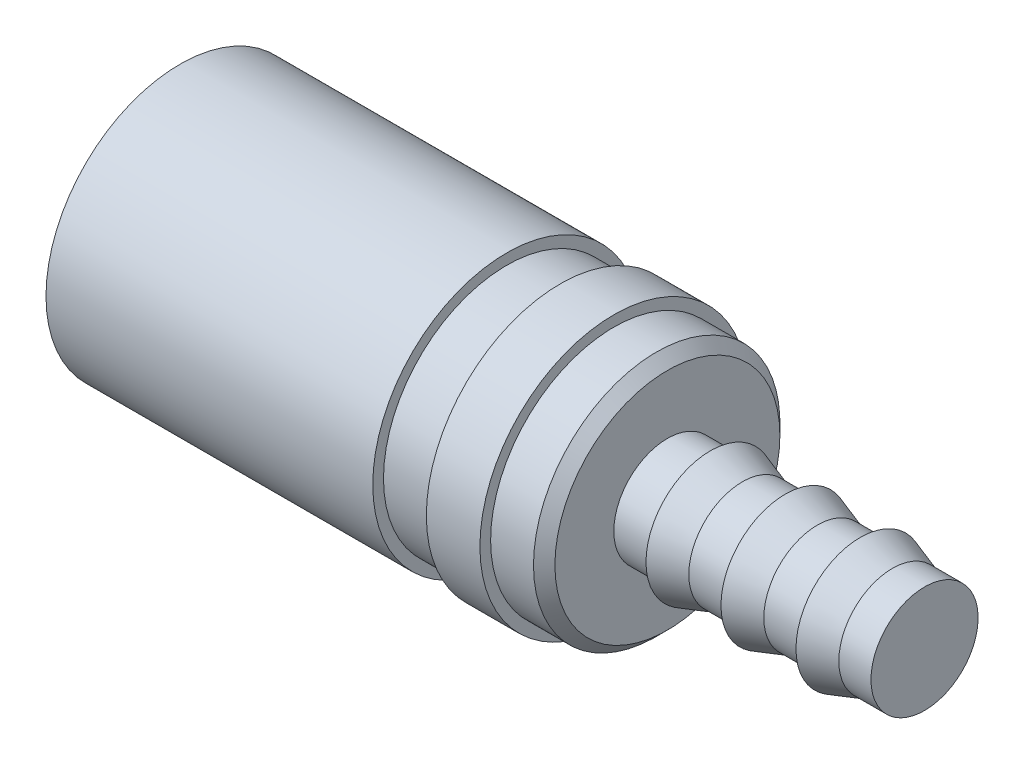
SolidWorks part; units mm, degrees
ref_plane "Alzado" through (0, 0, 0) normal (0, 0, 1) x (1, 0, 0)
ref_plane "Planta" through (0, 0, 0) normal (0, 1, 0) x (1, 0, 0)
ref_plane "Vista lateral" through (0, 0, 0) normal (1, 0, 0) x (0, 0, -1)
sketch "Croquis1" plane through (0, 0, 0) normal (0, 0, 1) x (1, 0, 0)
  line L0 (0, 0) -> (36.1529, 0) construction
  line L1 (0, 0) -> (0, 12.5)
  line L2 (0, 12.5) -> (30.5, 12.5)
  line L3 (30.5, 12.5) -> (30.5, 11.5)
  line L4 (30.5, 11.5) -> (35.5, 11.5)
  line L5 (35.5, 11.5) -> (35.5, 12.5)
  line L6 (35.5, 12.5) -> (40.5, 12.5)
  line L7 (40.5, 12.5) -> (40.5, 11.5)
  line L8 (40.5, 11.5) -> (45.5, 11.5)
  line L9 (45.5, 11.5) -> (45.5, 5)
  line L15 (0, 0) -> (69.5, 0)
  line L16 (69.5, 0) -> (69.5, 5)
  line L17 (45.5, 5) -> (49.5, 5)
  line L18 (49.5, 5) -> (49.5, 6)
  line L19 (49.5, 6) -> (52.5, 5)
  line L20 (52.5, 5) -> (56.5, 5)
  line L21 (56.5, 5) -> (56.5, 6)
  line L22 (56.5, 6) -> (59.5, 5)
  line L23 (59.5, 5) -> (63.5, 5)
  line L24 (63.5, 5) -> (63.5, 6)
  line L25 (63.5, 6) -> (66.5, 5)
  line L26 (66.5, 5) -> (69.5, 5)
  point P17 (64, 3.8052)
  dimension "D1" = 25
  dimension "D2" = 30.5
  dimension "D3" = 1
  dimension "D4" = 5
  dimension "D5" = 5
  dimension "D6" = 5
  dimension "D7" = 10
  dimension "D8" = 1
  dimension "D9" = 3
  dimension "D10" = 24
  dimension "D11" = 4
revolve "Revolución1" add sketch "Croquis1" angle 360 about L0
chamfer "Chaflán1" distance 1 angle 45 1 edges at (45.5, 0, 11.5)
